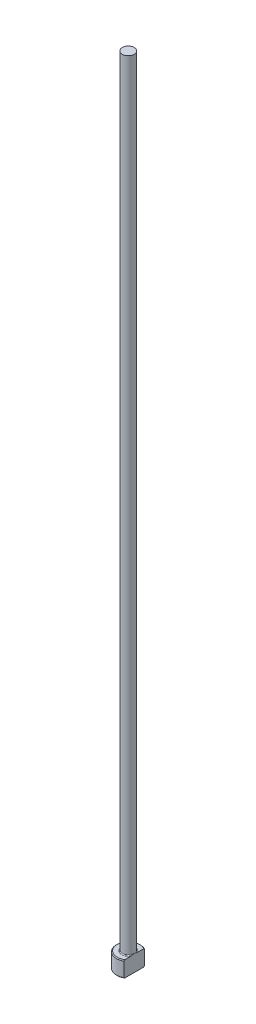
SolidWorks part; units mm, degrees
ref_plane "Front Plane" through (0, 0, 0) normal (0, 0, 1) x (1, 0, 0)
ref_plane "Top Plane" through (0, 0, 0) normal (0, 1, 0) x (1, 0, 0)
ref_plane "Right Plane" through (0, 0, 0) normal (1, 0, 0) x (0, 0, -1)
sketch "Sketch1" plane through (0, 0, 0) normal (0, 0, 1) x (1, 0, 0)
  line L0 (0, 259.9588) -> (0, -15.1925) construction
  line L1 (0, 0) -> (-3, 0)
  line L2 (-3, 0) -> (-3, 4)
  line L3 (-3, 4) -> (-1.5, 4)
  line L4 (-1.5, 4) -> (-1.5, 200)
  line L5 (-1.5, 200) -> (0, 200)
  line L6 (0, 200) -> (0, 0)
  dimension "L" = 200
  dimension "H" = 6
  dimension "T" = 4
  dimension "D" = 3
revolve "Revolve1" add sketch "Sketch1" angle 360 about L0
chamfer "Chamfer1" distance 0.2 angle 45 2 edges at (0, 4, 3) (0, 0, 3)
fillet "Fillet1" radius 0.2 1 edges at (0, 4, 1.5)
sketch "Sketch2" plane through (0, 0, 0) normal (0, 1, 0) x (1, 0, 0)
  line L0 (1.5, -2.5981) -> (1.5, 2.5981)
  circle A0 centre (0, 0) radius 3 construction
  arc A1 (1.5, -2.5981) -> (1.5, 2.5981) centre (0, 0) ccw
  circle A2 centre (0, 0) radius 1.5 construction
extrude "KEYED HEAD" cut sketch "Sketch2" along normal through all
